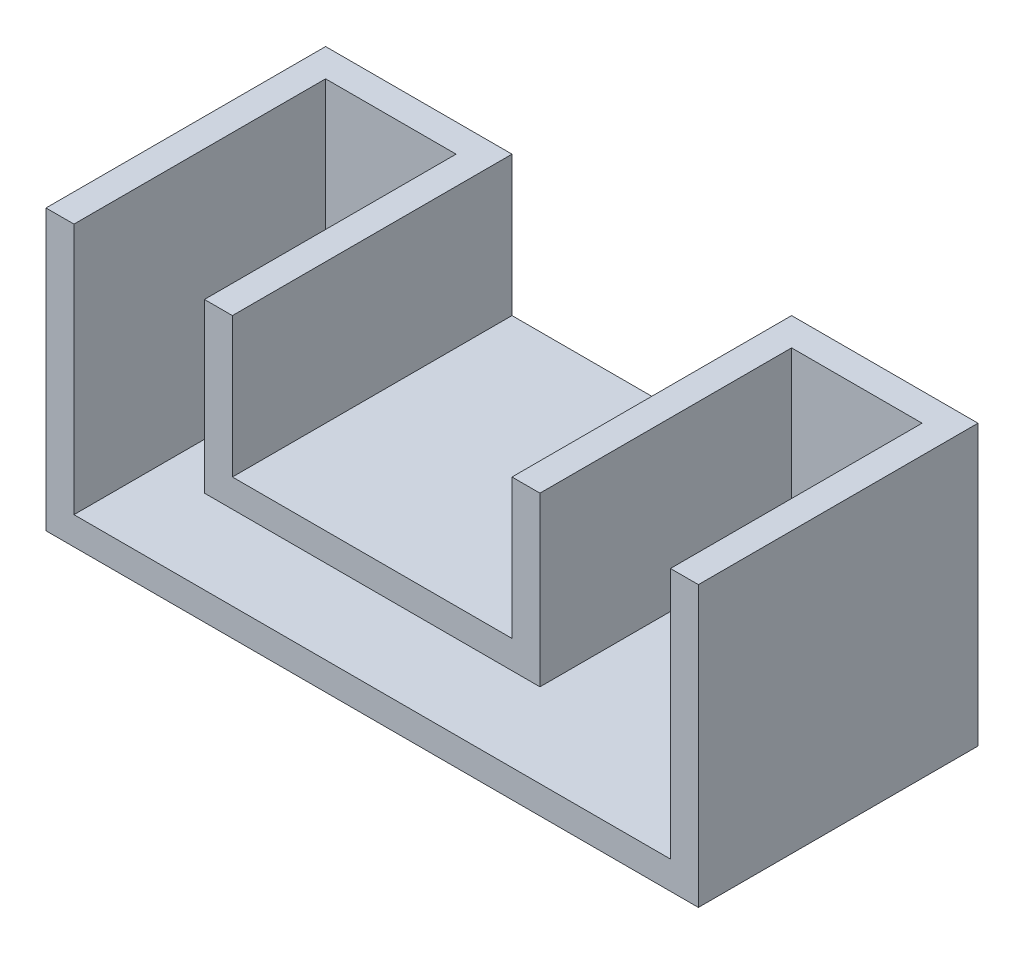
SolidWorks part; units mm, degrees
ref_plane "Front Plane" through (0, 0, 0) normal (0, 0, 1) x (1, 0, 0)
ref_plane "Top Plane" through (0, 0, 0) normal (0, 1, 0) x (1, 0, 0)
ref_plane "Right Plane" through (0, 0, 0) normal (1, 0, 0) x (0, 0, -1)
sketch "Sketch1" plane through (0, 0, 0) normal (0, 0, 1) x (1, 0, 0)
  line L0 (0, 0) -> (0, 30)
  line L1 (0, 30) -> (20, 30)
  line L2 (20, 30) -> (20, 15)
  line L3 (20, 15) -> (50, 15)
  line L4 (50, 15) -> (50, 30)
  line L5 (50, 30) -> (70, 30)
  line L6 (70, 30) -> (70, 0)
  line L7 (70, 0) -> (0, 0)
  dimension "D1" = 30
  dimension "D2" = 20
  dimension "D3" = 70
  dimension "D4" = 15
extrude "Extrude1" add sketch "Sketch1" along normal mid plane 30
shell "Shell1" thickness 3
